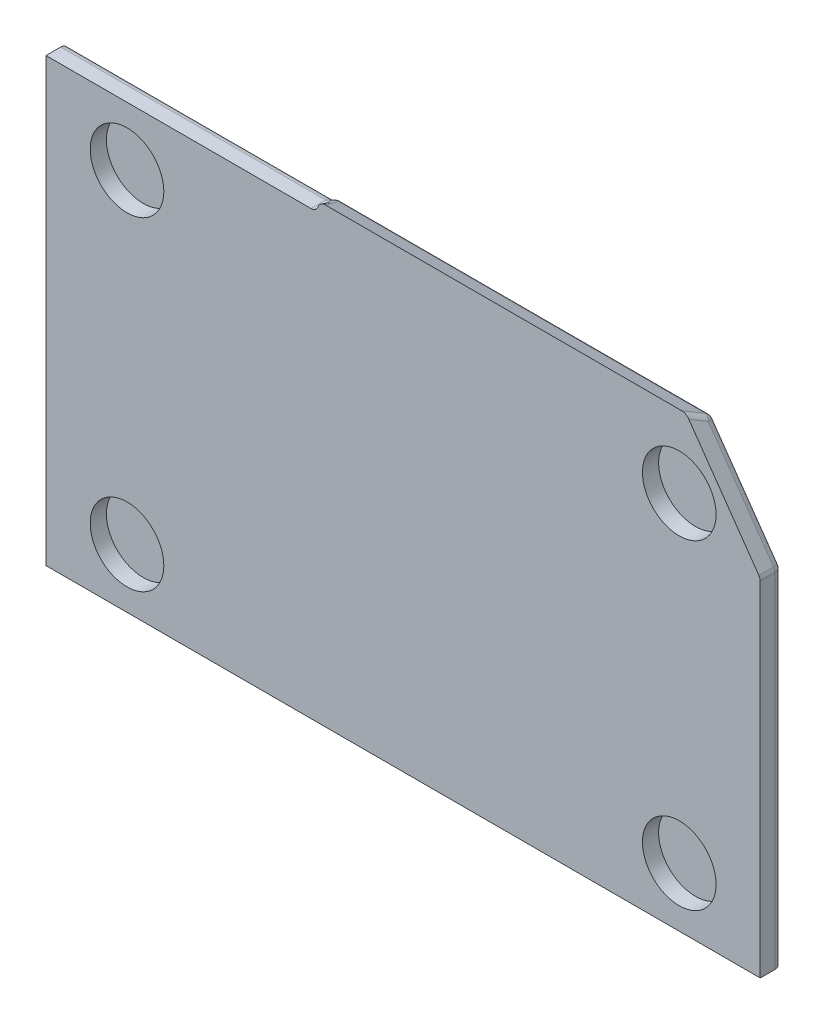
SolidWorks part; units mm, degrees
ref_plane "Ebene vorne" through (0, 0, 0) normal (0, 0, 1) x (1, 0, 0)
ref_plane "Ebene oben" through (0, 0, 0) normal (0, 1, 0) x (1, 0, 0)
ref_plane "Ebene rechts" through (0, 0, 0) normal (1, 0, 0) x (0, 0, -1)
sketch "Skizze1" plane through (0, 0, 0) normal (0, 0, 1) x (1, 0, 0)
  line L0 (0, 0) -> (0, 60)
  line L1 (0, 60) -> (37, 60)
  line L2 (37, 60) -> (37, 61.39)
  line L3 (37, 61.39) -> (86.93, 61.39)
  line L4 (86.93, 61.39) -> (97, 47)
  line L5 (97, 47) -> (97, 0)
  line L6 (97, 0) -> (0, 0)
  dimension "D1" = 97
  dimension "D2" = 60
  dimension "D3" = 47
  dimension "D4" = 37
  dimension "D5" = 1.39
  dimension "D6" = 49.93
extrude "Aufsatz-Linear austragen1" add sketch "Skizze1" along normal blind 3
sketch "Skizze2" plane through (0, 0, 3) normal (0, 0, 1) x (1, 0, 0)
  line L0 (97, 0) -> (97, 47) construction
  line L1 (0, 0) -> (97, 0) construction
  line L3 (0, 60) -> (0, 0) construction
  line L4 (37, 60) -> (0, 60) construction
  circle A0 centre (11, 52) radius 5
  circle A1 centre (86, 51.5) radius 5
  circle A2 centre (86, 8) radius 5
  circle A3 centre (11, 8) radius 5
  dimension "D1" = 10
  dimension "D2" = 10
  dimension "D3" = 10
  dimension "D4" = 10
  dimension "D5" = 11
  dimension "D6" = 8
  dimension "D7" = 11
  dimension "D8" = 43.5
  dimension "D9" = 11
  dimension "D10" = 8
  dimension "D11" = 11
  dimension "D12" = 8
extrude "Schnitt-Linear austragen1" cut sketch "Skizze2" against normal blind 2.2
sketch "Skizze3" plane through (37, 0, 0) normal (-1, 0, 0) x (0, 0, 1)
  line L0 (0, 61.39) -> (3, 61.39)
  line L1 (3, 61.39) -> (0, 60)
  line L2 (0, 60) -> (0, 61.39)
extrude "Schnitt-Linear austragen2" cut sketch "Skizze3" against normal blind 73.1
fillet "Verrundung2" radius 1 1 edges at (37, 60, 1.5)
fillet "Verrundung4" radius 1 1 edges at (37, 61.195, 2.5791)
fillet "Verrundung5" radius 1 7 edges at (17.6991, 60, 0) (62.2522, 60, 0) (92.4514, 53.5, 0) (97, 23.5, 0) (87.4164, 60.695, 1.5) (97, 47, 1.5)
